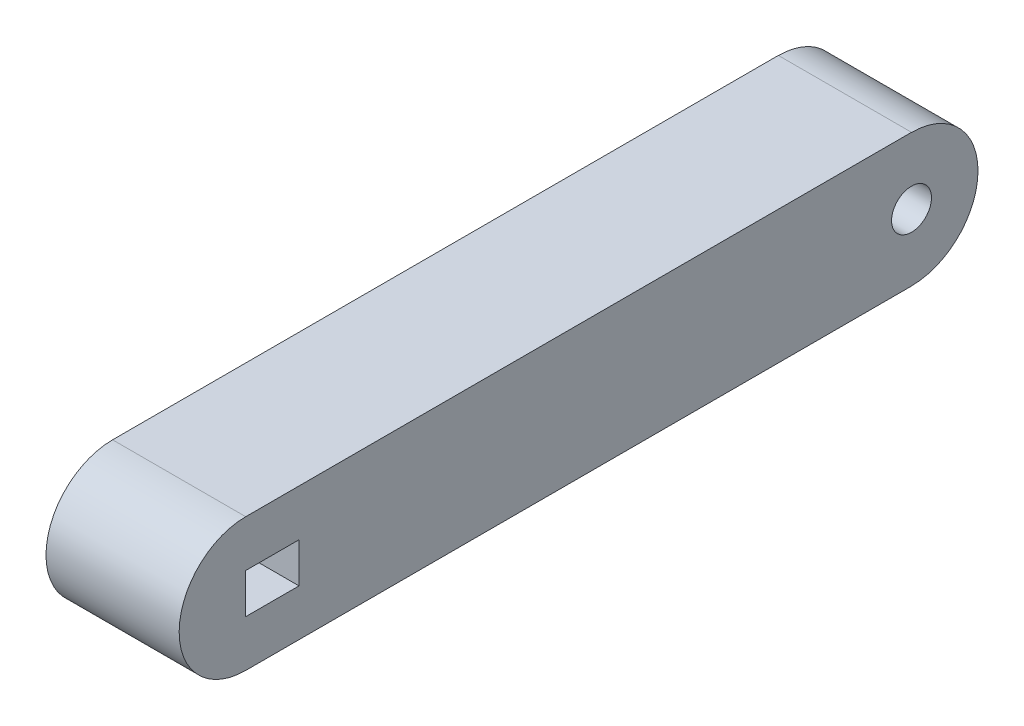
SolidWorks part; units mm, degrees
ref_plane "Front Plane" through (0, 0, 0) normal (0, 0, 1) x (1, 0, 0)
ref_plane "Top Plane" through (0, 0, 0) normal (0, 1, 0) x (1, 0, 0)
ref_plane "Right Plane" through (0, 0, 0) normal (1, 0, 0) x (0, 0, -1)
sketch "Sketch1" plane through (0, 0, 0) normal (1, 0, 0) x (0, 0, -1)
  line L1 (-63.5, 12.7) -> (63.5, 12.7)
  line L2 (-63.5, 12.7) -> (-63.5, -12.7)
  line L3 (-63.5, -12.7) -> (63.5, -12.7)
  line L4 (63.5, 12.7) -> (63.5, -12.7)
  line L5 (-63.5, 12.7) -> (63.5, -12.7) construction
  line L6 (-63.5, -12.7) -> (63.5, 12.7) construction
  point P0 (0, 0)
  dimension "D1" = 25.4
  dimension "D2" = 127
extrude "Boss-Extrude1" add sketch "Sketch1" along normal blind 25.4
sketch "Sketch5" plane through (0, 0, 0) normal (1, 0, 0) x (0, 0, -1)
  line L0 (-63.5, 12.7) -> (-63.5, -12.7) construction
  circle A0 centre (-63.5, 0) radius 12.7
extrude "Boss-Extrude3" add sketch "Sketch5" along normal blind 25.4
sketch3d "3DSketch1"
  point P0 (0, 5.5419, -2.2264)
sketch "Sketch26" plane through (25.4, 0, 0) normal (1, 0, 0) x (0, 0, -1)
  line L0 (63.5, -12.7) -> (63.5, 12.7) construction
  circle A0 centre (63.5, 0) radius 12.6813
extrude "Boss-Extrude4" add sketch "Sketch26" against normal blind 25.4
sketch "Sketch27" plane through (25.4, 0, 0) normal (1, 0, 0) x (0, 0, -1)
  circle A0 centre (63.5, 0) radius 3.81
  dimension "D1" = 7.62
sketch "Sketch28" plane through (0, 0, 0) normal (1, 0, 0) x (0, 0, -1)
  circle A0 centre (63.5, 0) radius 10.8525
extrude "Cut-Extrude1" cut sketch "Sketch27" against normal through all
sketch "Sketch29" plane through (25.4, 0, 0) normal (1, 0, 0) x (0, 0, -1)
  line L1 (-63.5, -3.81) -> (-53.34, -3.81)
  line L2 (-63.5, -3.81) -> (-63.5, 3.81)
  line L3 (-63.5, 3.81) -> (-53.34, 3.81)
  line L4 (-53.34, -3.81) -> (-53.34, 3.81)
  point P4 (-53.34, 0)
  dimension "D1" = 10.16
  dimension "D2" = 7.62
extrude "Cut-Extrude4" cut sketch "Sketch29" against normal through all
